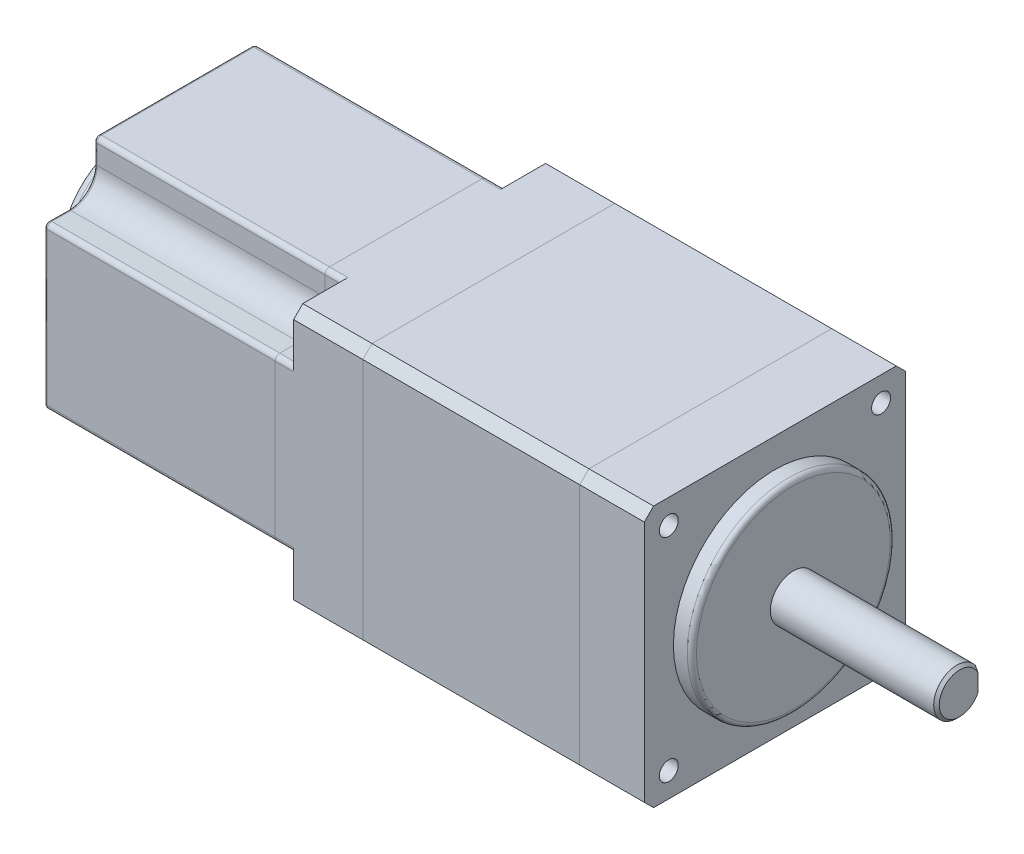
SolidWorks part; units mm, degrees
ref_plane "前视基准面" through (0, 0, 0) normal (0, 0, 1) x (1, 0, 0)
ref_plane "上视基准面" through (0, 0, 0) normal (0, 1, 0) x (1, 0, 0)
ref_plane "右视基准面" through (0, 0, 0) normal (1, 0, 0) x (0, 0, -1)
sketch "草图1" plane through (0, 0, 0) normal (1, 0, 0) x (0, 0, -1)
  line L0 (-14.15, 13.65) -> (-13.65, 14.15)
  line L1 (13.65, 14.15) -> (14.15, 13.65)
  line L2 (14.15, 13.65) -> (14.15, -13.65)
  line L3 (13.65, -14.15) -> (-13.65, -14.15)
  line L4 (-14.15, -13.65) -> (-14.15, 13.65)
  line L5 (-13.65, 14.15) -> (13.65, 14.15)
  line L6 (14.15, -13.65) -> (13.65, -14.15)
  line L7 (-13.65, -14.15) -> (-14.15, -13.65)
  point P4 (14.15, 14.15)
  point P5 (14.15, -14.15)
  point P6 (-14.15, -14.15)
  point P7 (-14.15, 14.15)
extrude "凸台-拉伸1" add sketch "草图1" against normal blind 7
sketch "草图2" plane through (-7, 0, 0) normal (-1, 0, 0) x (0, 0, 1)
  line L0 (-14.15, -13.65) -> (-13.65, -14.15)
  line L2 (13.65, -14.15) -> (14.15, -13.65)
  line L3 (-13.65, -14.15) -> (13.65, -14.15)
  line L4 (14.15, -13.65) -> (14.15, 13.65)
  line L5 (13.65, 14.15) -> (-13.65, 14.15)
  line L6 (-14.15, 13.65) -> (-14.15, -13.65)
  line L7 (14.15, 13.65) -> (13.65, 14.15)
  line L8 (-13.65, 14.15) -> (-14.15, 13.65)
  point P6 (-14.15, -14.15)
  point P7 (14.15, -14.15)
  point P8 (14.15, 14.15)
  point P9 (-14.15, 14.15)
extrude "凸台-拉伸2" add sketch "草图2" along normal blind 23.5 separate body
sketch "草图3" plane through (-30.5, 0, 0) normal (-1, 0, 0) x (0, 0, 1)
  line L0 (-14.15, -13.65) -> (-14.15, 13.65)
  line L2 (-13.65, -14.15) -> (-14.15, -13.65)
  line L3 (-13.65, 14.15) -> (13.65, 14.15)
  line L4 (14.15, 13.65) -> (14.15, -13.65)
  line L5 (13.65, -14.15) -> (-13.65, -14.15)
  line L6 (-14.15, 13.65) -> (-13.65, 14.15)
  line L7 (13.65, 14.15) -> (14.15, 13.65)
  line L8 (14.15, -13.65) -> (13.65, -14.15)
  point P5 (-14.15, 14.15)
  point P7 (14.15, 14.15)
  point P8 (14.15, -14.15)
  point P9 (-14.15, -14.15)
extrude "凸台-拉伸3" add sketch "草图3" along normal blind 9.5 separate body
sketch "草图4" plane through (0, 0, 0) normal (1, 0, 0) x (0, 0, -1)
  circle A0 centre (0, 0) radius 11
extrude "凸台-拉伸4" add sketch "草图4" along normal blind 2
fillet "圆角1" radius 0.5 1 edges at (2, 0, -11)
sketch "草图5" plane through (2, 0, 0) normal (1, 0, 0) x (0, 0, -1)
  circle A0 centre (0, 0) radius 2.5
extrude "凸台-拉伸5" add sketch "草图5" along normal blind 18
chamfer "倒角1" distance 0.3 angle 45 1 edges at (20, 0, -2.5)
sketch "草图7" plane through (20, 0, 0) normal (1, 0, 0) x (0, 0, -1)
  line L2 (2, -1.5) -> (2, 1.5)
  arc A0 (2, -1.5) -> (2, 1.5) centre (0, 0) ccw
extrude "切除-拉伸2" cut sketch "草图7" against normal blind 15
sketch "草图8" plane through (-40, 0, 0) normal (-1, 0, 0) x (0, 0, 1)
  line L0 (-8.75, -11.45) -> (-8.75, -14.15)
  line L1 (-13.65, -14.15) -> (13.65, -14.15) construction
  line L2 (-11.45, -8.75) -> (-14.15, -8.75)
  line L3 (8.75, -11.45) -> (8.75, -14.15)
  line L4 (11.45, -8.75) -> (14.15, -8.75)
  line L5 (14.15, -13.65) -> (14.15, 13.65) construction
  line L6 (-14.15, 13.65) -> (-14.15, -13.65) construction
  line L7 (-11.45, 8.75) -> (-14.15, 8.75)
  line L8 (-8.75, 11.45) -> (-8.75, 14.15)
  line L10 (13.65, 14.15) -> (-13.65, 14.15) construction
  line L11 (11.45, 8.75) -> (14.15, 8.75)
  line L12 (8.75, 11.45) -> (8.75, 14.15)
  line L13 (14.15, -8.75) -> (14.15, -13.65)
  line L14 (14.15, -13.65) -> (13.65, -14.15)
  line L15 (13.65, -14.15) -> (8.75, -14.15)
  line L16 (-8.75, -14.15) -> (-13.65, -14.15)
  line L17 (-13.65, -14.15) -> (-14.15, -13.65)
  line L18 (-14.15, -13.65) -> (-14.15, -8.75)
  line L19 (-14.15, 8.75) -> (-14.15, 13.65)
  line L20 (-14.15, 13.65) -> (-13.65, 14.15)
  line L21 (-13.65, 14.15) -> (-8.75, 14.15)
  line L22 (8.75, 14.15) -> (13.65, 14.15)
  line L23 (13.65, 14.15) -> (14.15, 13.65)
  line L24 (14.15, 13.65) -> (14.15, 8.75)
  arc A0 (11.45, -8.75) -> (8.75, -11.45) centre (11.45, -11.45) ccw
  arc A1 (-8.75, -11.45) -> (-11.45, -8.75) centre (-11.45, -11.45) ccw
  arc A2 (8.75, 11.45) -> (11.45, 8.75) centre (11.45, 11.45) ccw
  arc A3 (-11.45, 8.75) -> (-8.75, 11.45) centre (-11.45, 11.45) ccw
extrude "切除-拉伸3" cut sketch "草图8" against normal blind 2
sketch "草图9" plane through (-40, 0, 0) normal (-1, 0, 0) x (0, 0, 1)
  line L3 (14.15, -8.25) -> (14.15, -8.75)
  line L10 (14.15, -8.75) -> (13.65, -8.75)
  line L14 (8.75, -13.65) -> (8.75, -14.15)
  line L15 (8.75, -14.15) -> (8.25, -14.15)
  line L16 (-8.25, -14.15) -> (-8.75, -14.15)
  line L17 (-8.75, -14.15) -> (-8.75, -13.65)
  line L18 (-13.65, -8.75) -> (-14.15, -8.75)
  line L19 (-14.15, -8.75) -> (-14.15, -8.25)
  line L20 (-14.15, 8.25) -> (-14.15, 8.75)
  line L21 (-14.15, 8.75) -> (-13.65, 8.75)
  line L22 (-8.75, 13.65) -> (-8.75, 14.15)
  line L23 (-8.75, 14.15) -> (-8.25, 14.15)
  line L24 (8.25, 14.15) -> (8.75, 14.15)
  line L25 (8.75, 14.15) -> (8.75, 13.65)
  line L26 (13.65, 8.75) -> (14.15, 8.75)
  line L27 (14.15, 8.75) -> (14.15, 8.25)
  arc A2 (14.15, 8.25) -> (13.65, 8.75) centre (13.65, 8.25) ccw
  arc A3 (8.75, 13.65) -> (8.25, 14.15) centre (8.25, 13.65) ccw
  arc A4 (-8.25, 14.15) -> (-8.75, 13.65) centre (-8.25, 13.65) ccw
  arc A5 (-13.65, 8.75) -> (-14.15, 8.25) centre (-13.65, 8.25) ccw
  arc A6 (-14.15, -8.25) -> (-13.65, -8.75) centre (-13.65, -8.25) ccw
  arc A7 (-8.75, -13.65) -> (-8.25, -14.15) centre (-8.25, -13.65) ccw
  arc A8 (8.25, -14.15) -> (8.75, -13.65) centre (8.25, -13.65) ccw
  arc A9 (14.15, -8.25) -> (13.65, -8.75) centre (13.65, -8.25) cw
  point P37 (14.15, 8.75)
  point P40 (8.75, 14.15)
  point P43 (-8.75, 14.15)
  point P46 (-14.15, 8.75)
  point P49 (-14.15, -8.75)
  point P52 (-8.75, -14.15)
  point P55 (8.75, -14.15)
  point P58 (14.15, -8.75)
  dimension "D1" = 0.5
extrude "切除-拉伸4" cut sketch "草图9" against normal blind 2
sketch "草图10" plane through (-38, 0, 0) normal (-1, 0, 0) x (0, 0, 1)
  circle A0 centre (11.45, -11.45) radius 1.5
sketch "草图11" plane through (-38, 0, 0) normal (-1, 0, 0) x (0, 0, 1)
  circle A0 centre (-11.45, -11.45) radius 1.5
sketch "草图12" plane through (-38, 0, 0) normal (-1, 0, 0) x (0, 0, 1)
  circle A0 centre (-11.45, 11.45) radius 1.5
sketch "草图13" plane through (-38, 0, 0) normal (-1, 0, 0) x (0, 0, 1)
  circle A0 centre (11.45, 11.45) radius 1.3331
extrude "凸台-拉伸12" add sketch "草图13" along normal blind 0.5
extrude "凸台-拉伸13" add sketch "草图10" along normal blind 0.5 contours A0
extrude "凸台-拉伸14" add sketch "草图11" along normal blind 0.5 contours A0
extrude "凸台-拉伸15" add sketch "草图12" along normal blind 0.5 contours A0
fillet "圆角5" radius 0.5 4 edges at (-38.5, -11.45, 12.95) (-38.5, -11.45, -9.95) (-38.5, 11.45, -9.95) (-38.5, 11.45, 12.7831)
sketch "草图15" plane through (0, 0, 14.15) normal (0, 0, 1) x (1, 0, 0)
  line L0 (-40, -8.25) -> (-40, 8.25)
  line L1 (-40, 8.25) -> (-46, 8.25)
  line L2 (-46, 8.25) -> (-46, -8.25)
  line L3 (-46, -8.25) -> (-40, -8.25)
  line L4 (-40, -8.25) -> (-50.8992, -8.3692)
extrude "凸台-拉伸17" add sketch "草图15" along normal blind 3.5 separate body contours L3 L2 L1 M8 M1 M2
sketch "草图17" plane through (0, 0, 0) normal (1, 0, 0) x (0, 0, -1)
  point P1 (11.5, -11.5)
  point P7 (-11.5, -11.5)
  point P9 (-11.5, 11.5)
  point P10 (11.5, 11.5)
hole_wizard "M2.5 螺纹孔1" positions "3D草图1" profile "草图18" tap size "M2.5" standard "GB"
sketch3d "3D草图1"
  point P0 (0, -11.5, -11.5)
  point P3 (0, -11.5, 11.5)
  point P6 (0, 11.5, 11.5)
  point P9 (0, 11.5, -11.5)
sketch "草图18" plane through (0, -11.5, -11.5) normal (0, 1, 0) x (0, 0, -1)
  line L0 (0, 0) -> (0, 3.1159)
  line L1 (0, 3.1159) -> (1.025, 2.5)
  line L2 (1.025, 2.5) -> (1.025, 0)
  line L5 (1.025, 0) -> (0, 0)
  line L10 (0, 3.1159) -> (-1.025, 2.5) construction
  line L11 (0, -6.35) -> (0, 107.95) construction
  dimension "螺纹孔钻头直径" = 2.05
  dimension "螺纹孔钻头深度" = 2.5
  dimension "导头角度" = 118
sketch "草图19" plane through (0, 0, 0) normal (1, 0, 0) x (0, 0, -1)
  line L0 (13.65, -14.15) -> (13.15, -14.15)
  line L1 (-13.65, -14.15) -> (13.65, -14.15) construction
  line L2 (14.15, -13.65) -> (14.15, -13.15)
  line L3 (14.15, -13.65) -> (14.15, 13.65) construction
  line L4 (14.15, 13.65) -> (14.15, 13.15)
  line L5 (13.65, 14.15) -> (13.15, 14.15)
  line L6 (13.65, 14.15) -> (-13.65, 14.15) construction
  line L7 (-13.65, 14.15) -> (-13.15, 14.15)
  line L8 (-14.15, 13.65) -> (-14.15, 13.15)
  line L9 (-14.15, 13.65) -> (-14.15, -13.65) construction
  line L10 (-14.15, -13.65) -> (-14.15, -13.15)
  line L11 (-14.15, -13.65) -> (-13.65, -14.15)
  line L12 (-13.65, -14.15) -> (-13.15, -14.15)
  line L13 (-13.15, -14.15) -> (-14.15, -13.15)
  line L14 (14.15, -13.65) -> (13.65, -14.15)
  line L15 (13.15, -14.15) -> (14.15, -13.15)
  line L16 (14.15, 13.15) -> (13.15, 14.15)
  line L17 (14.15, 13.65) -> (13.65, 14.15)
  line L18 (-13.15, 14.15) -> (-14.15, 13.15)
  line L19 (-14.15, 13.65) -> (-13.65, 14.15)
extrude "切除-拉伸6" cut sketch "草图19" against normal blind 49
sketch "草图20" plane through (-40, 0, 0) normal (-1, 0, 0) x (0, 0, 1)
  line L1 (8.7298, -11.5534) -> (8.75, -13.65)
  line L2 (-14.15, -8.25) -> (-14.15, 8.25)
  line L3 (-8.75, 13.65) -> (-8.75, 11.8381)
  line L4 (14.15, -8.25) -> (14.15, 8.25)
  line L5 (8.75, -13.65) -> (8.7477, -13.6738)
  line L6 (-11.5534, 8.7298) -> (-13.6404, 8.7499)
  line L7 (-13.6404, -8.7499) -> (-11.5559, -8.7316)
  line L8 (8.7298, 11.5534) -> (8.75, 13.65)
  line L9 (-11.5559, -8.7316) -> (-11.5947, -8.6948)
  line L10 (11.5534, 8.7298) -> (13.6404, 8.7499)
  line L11 (-8.25, -14.15) -> (8.25, -14.15)
  line L12 (-8.25, 14.15) -> (8.25, 14.15)
  line L13 (-8.75, -13.65) -> (-8.7483, -11.8087)
  line L15 (11.45, -8.75) -> (13.65, -8.75)
  line L18 (14.15, 8.25) -> (14.15, -8.25)
  line L21 (8.25, 14.15) -> (-8.25, 14.15)
  line L27 (-14.15, 8.25) -> (-14.15, -8.25)
  line L29 (-8.25, -14.15) -> (8.25, -14.15)
  arc A1 (-11.5534, 8.7298) -> (-8.75, 11.8381) centre (-11.5, 11.5) ccw
  arc A2 (11.8381, -8.75) -> (8.7298, -11.5534) centre (11.5, -11.5) ccw
  arc A3 (8.7298, 11.5534) -> (11.5534, 8.7298) centre (11.5, 11.5) ccw
  arc A4 (-13.6404, 8.7499) -> (-14.15, 8.25) centre (-13.65, 8.25) ccw
  arc A5 (-8.25, 14.15) -> (-8.75, 13.65) centre (-8.25, 13.65) ccw
  arc A6 (8.7499, 13.6404) -> (8.25, 14.15) centre (8.25, 13.65) ccw
  arc A7 (14.15, 8.25) -> (13.6404, 8.7499) centre (13.65, 8.25) ccw
  arc A8 (13.65, -8.75) -> (14.15, -8.25) centre (13.65, -8.25) ccw
  arc A9 (8.25, -14.15) -> (8.7499, -13.6404) centre (8.25, -13.65) ccw
  arc A10 (-8.75, -13.6491) -> (-8.25, -14.15) centre (-8.25, -13.65) ccw
  arc A11 (-14.15, -8.25) -> (-13.6404, -8.7499) centre (-13.65, -8.25) ccw
  arc A12 (-8.7483, -11.8087) -> (-11.5559, -8.7316) centre (-11.5, -11.5) ccw
  point P0 (0, 0)
extrude "凸台-拉伸18" add sketch "草图20" along normal blind 25 separate body
fillet "圆角8" radius 0.3 26 edges at (-65, 8.7399, -12.5969) (-65, 8.6069, -14.0001) (-65, 0, -14.15) (-65, -8.6069, -14.0001) (-65, -8.7407, -12.5982) (-65, -10.8746, -8.8026) (-65, -12.7294, -8.7491) (-65, -14.0036, -8.6036) (-65, -14.15, 0) (-65, -14.0036, 8.6036) (-65, -12.6017, 8.7399) (-65, -9.4425, 9.6443) (-65, -8.75, 12.7441) (-65, -8.6036, 14.0036) (-65, -8.834, -10.7519) (-65, 0, 14.15) (-65, 8.6069, 14.0001) (-65, 8.7399, 12.5969) (-65, 9.5408, 9.5408) (-65, 12.6017, 8.7399) (-65, 14.0036, 8.6036) (-65, 14.15, 0) (-65, 14.0036, -8.6036) (-65, -9.5408, -9.5408) (-65, 12.7441, -8.75) (-65, 9.6443, -9.4425)
sketch "草图22" plane through (-65, 0, 0) normal (-1, 0, 0) x (0, 0, 1)
  circle A0 centre (0, 0) radius 8
extrude "凸台-拉伸20" add sketch "草图22" along normal blind 5
fillet "圆角9" radius 1 1 edges at (-70, 0, 8)
sketch "草图24" plane through (-40, 0, 0) normal (-1, 0, 0) x (0, 0, 1)
  line L0 (14.15, 8.25) -> (17.65, 8.25)
  line L1 (17.65, 8.25) -> (17.65, -8.25)
  line L2 (17.65, -8.25) -> (14.15, -8.25)
  line L3 (14.15, -8.25) -> (14.15, 8.25)
extrude "切除-拉伸7" cut sketch "草图24" against normal blind 9.5
sketch "草图25" plane through (-38, 0, 0) normal (-1, 0, 0) x (0, 0, 1)
  line L0 (17.65, 13.65) -> (14.15, 13.65)
  line L2 (17.65, 13.65) -> (17.65, 8.25)
  line L3 (14.15, 13.65) -> (14.15, 8.25)
  line L5 (14.15, 8.25) -> (17.65, 8.25)
  line L6 (14.15, -8.25) -> (17.65, -8.25)
  line L7 (17.65, -8.25) -> (17.65, -13.65)
  line L8 (17.65, -13.65) -> (14.15, -13.65)
  line L9 (14.15, -13.65) -> (14.15, -8.25)
extrude "切除-拉伸8" cut sketch "草图25" against normal blind 7.5
